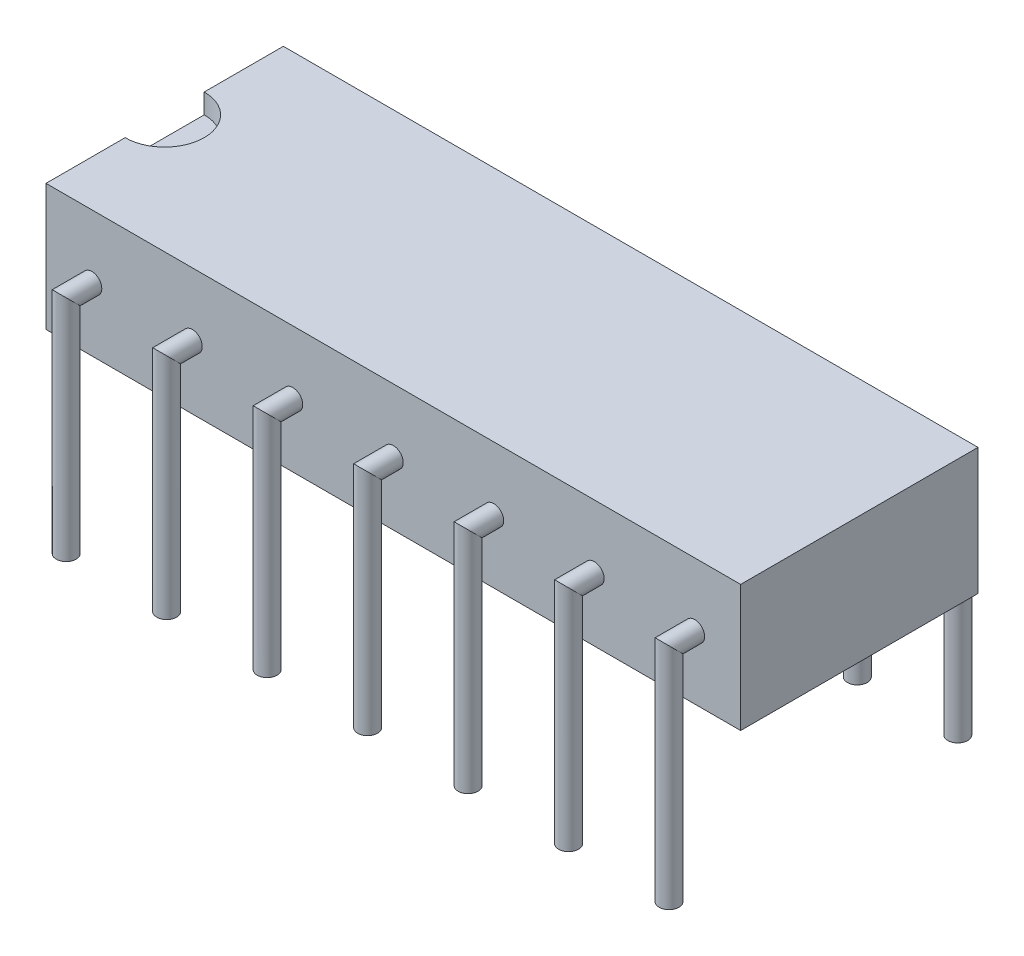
SolidWorks part; units mm, degrees
ref_plane "Plan de face" through (0, 0, 0) normal (0, 0, 1) x (1, 0, 0)
ref_plane "Plan de dessus" through (0, 0, 0) normal (0, 1, 0) x (1, 0, 0)
ref_plane "Plan de droite" through (0, 0, 0) normal (1, 0, 0) x (0, 0, -1)
sketch "Esquisse1" plane through (0, 0, 0) normal (1, 0, 0) x (0, 0, -1)
  line L0 (-34.0084, 0) -> (28.7946, 0) construction
  line L1 (0, -15.76) -> (0, 25.9507) construction
  line L2 (-13.1897, 3.2) -> (13.1184, 3.2) construction
  line L3 (3, 10.112) -> (3, -6.1718) construction
  line L4 (-3, 10.112) -> (-3, -4.99) construction
  line L6 (-3, 3.2) -> (3, 3.2)
  line L7 (-3, 3.2) -> (-3, 0)
  line L8 (-3, 0) -> (3, 0)
  line L9 (3, 3.2) -> (3, 0)
  dimension "D1" = 3
  dimension "D2" = 6
  dimension "D3" = 3.2
extrude "Extrusion1" add sketch "Esquisse1" along normal blind 17.56
sketch "Esquisse2" plane through (0, 3.2, 0) normal (0, 1, 0) x (-1, 0, 0)
  line L0 (0, -1) -> (0, 1)
  arc A0 (0, 1) -> (0, -1) centre (0, 0) ccw
extrude "Enlèv. mat.-Extru.1" cut sketch "Esquisse2" against normal blind 0.5
sketch "Esquisse3" plane through (0, 0, 3) normal (0, 0, 1) x (1, 0, 0)
  line L0 (-0.9705, 0) -> (10.7632, 0) construction
  line L1 (0, 4.319) -> (0, -1.0907) construction
  line L2 (-0.7349, 1.6) -> (2.3847, 1.6) construction
  line L3 (1.16, 2.698) -> (1.16, -1.0907) construction
  circle A0 centre (1.16, 1.6) radius 0.25
  dimension "D1" = 1.6
  dimension "D2" = 1.16
ref_plane "Plan1" through (1.16, 0, 0) normal (1, 0, 0) x (0, 0, -1)
sketch "Esquisse5" plane through (1.16, 0, 0) normal (1, 0, 0) x (0, 0, -1)
  line L0 (-4.2866, 0) -> (4.976, 0) construction
  line L1 (-3, -1.7147) -> (-3, 5.2592) construction
  line L2 (-4.2866, -4) -> (4.976, -4) construction
  line L3 (-3.65, -4.4343) -> (-3.65, 4.8284) construction
  line L4 (-3.7349, 1.6) -> (-3, 1.6) construction
  line L5 (-3, 1.6) -> (-3.65, 1.6)
  line L6 (-3.65, 1.6) -> (-3.65, -4)
  dimension "D1" = 4
  dimension "D2" = 0.65
sweep "Balayage1" add profiles "Esquisse3" path "Esquisse5"
ref_plane "Plan2" through (0, 0, 0) normal (0, 0, 1) x (1, 0, 0)
mirror "Symétrie1" about plane through (0, 0, 0) normal (0, 0, 1) of "Balayage1"
pattern_linear "Répétition linéaire1" count 7 spacing 2.54 along (1, 0, 0) of "Balayage1", "Symétrie1"
